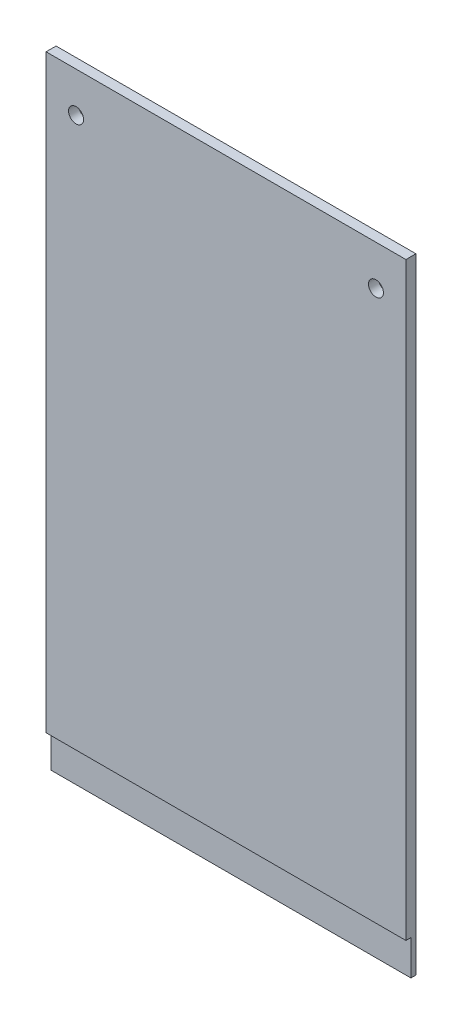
SolidWorks part; units mm, degrees
ref_plane "Front Plane" through (0, 0, 0) normal (0, 0, 1) x (1, 0, 0)
ref_plane "Top Plane" through (0, 0, 0) normal (0, 1, 0) x (1, 0, 0)
ref_plane "Right Plane" through (0, 0, 0) normal (1, 0, 0) x (0, 0, -1)
sketch "Sketch2" plane through (0, 0, 0) normal (0, 0, 1) x (1, 0, 0)
  line L1 (-36, 122) -> (36, 122)
  line L2 (-36, 122) -> (-36, -122)
  line L3 (-36, -122) -> (36, -122)
  line L4 (36, 122) -> (36, -122)
  line L5 (-36, 122) -> (36, -122) construction
  line L6 (-36, -122) -> (36, 122) construction
  point P0 (0, 0)
  dimension "D1" = 244
  dimension "D2" = 72
extrude "Boss-Extrude1" add sketch "Sketch2" along normal blind 2
sketch "Sketch3" plane through (0, 0, 2) normal (0, 0, 1) x (1, 0, 0)
  line L0 (86.8288, 114) -> (-86.8288, 114) construction
  line L1 (-92.684, -114) -> (92.684, -114) construction
  line L2 (36, 122) -> (-36, 122) construction
  line L3 (36, -122) -> (36, 122) construction
  line L4 (-36, 122) -> (-36, -122) construction
  circle A0 centre (30, 114) radius 1.5
  circle A1 centre (-30, 114) radius 1.5
  circle A2 centre (30, -114) radius 1.5
  circle A3 centre (-30, -114) radius 1.5
  point P3 (0, 114)
  point P6 (0, -114)
  dimension "D3" = 3
  dimension "D6" = 6
  dimension "D1" = 8
  dimension "D2" = 8
  dimension "D4" = 6
  dimension "D5" = 6
  dimension "D7" = 6
extrude "Cut-Extrude1" cut sketch "Sketch3" against normal through all
sketch "Sketch4" plane through (36, 0, 0) normal (1, 0, 0) x (0, 0, -1)
  line L4 (-1, -3) -> (-1, 4)
  line L5 (-1, 4) -> (-2, 4)
  line L7 (-2, -122) -> (-2, 122) construction
  line L8 (-1, -3) -> (-2, -3)
  line L9 (-2, -3) -> (-2, 4)
  dimension "D2" = 7
sketch "Sketch5" plane through (0, 0, 2) normal (0, 0, 1) x (1, 0, 0)
  line L0 (-36, -122) -> (-36, -3)
  line L1 (-36, 122) -> (-36, -122) construction
  line L2 (-36, -3) -> (36, -3)
  line L3 (36, -122) -> (36, 122) construction
  line L4 (36, -3) -> (36, -122)
  line L5 (36, -122) -> (-36, -122)
  line L6 (36, -3) -> (36, 4) construction
  point P5 (0, 0)
extrude "Cut-Extrude2" cut sketch "Sketch5" against normal through all
extrude "Cut-Extrude3" cut sketch "Sketch4" against normal through all
